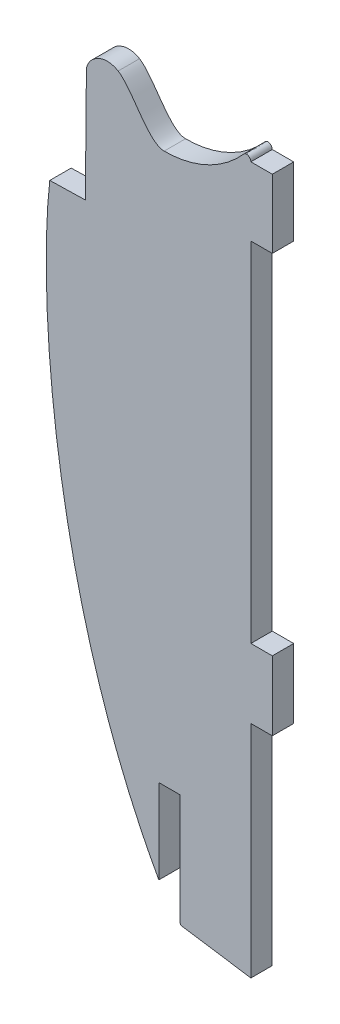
SolidWorks part; units mm, degrees
ref_plane "Alzado" through (0, 0, 0) normal (0, 0, 1) x (1, 0, 0)
ref_plane "Planta" through (0, 0, 0) normal (0, 1, 0) x (1, 0, 0)
ref_plane "Vista lateral" through (0, 0, 0) normal (1, 0, 0) x (0, 0, -1)
sketch "Croquis2" plane through (0, 0, 0) normal (0, 0, 1) x (1, 0, 0)
sketch_block_instance "F1 CAR CUT corte-1"
sketch_block "Bloque1"
extrude "Saliente-Extruir1" add sketch "Croquis2" along normal blind 3
delete or keep bodies "Sólido-Eliminar/Conservar 9" type delete bodies bodies 114 113 104 112 103
delete or keep bodies "Sólido-Eliminar/Conservar 10" type delete bodies bodies 101 108 102
delete or keep bodies "Sólido-Eliminar/Conservar 11" type delete bodies bodies 107 105 110
delete or keep bodies "Sólido-Eliminar/Conservar 12" type delete bodies bodies 111
delete or keep bodies "Sólido-Eliminar/Conservar 13" type delete bodies bodies 109
